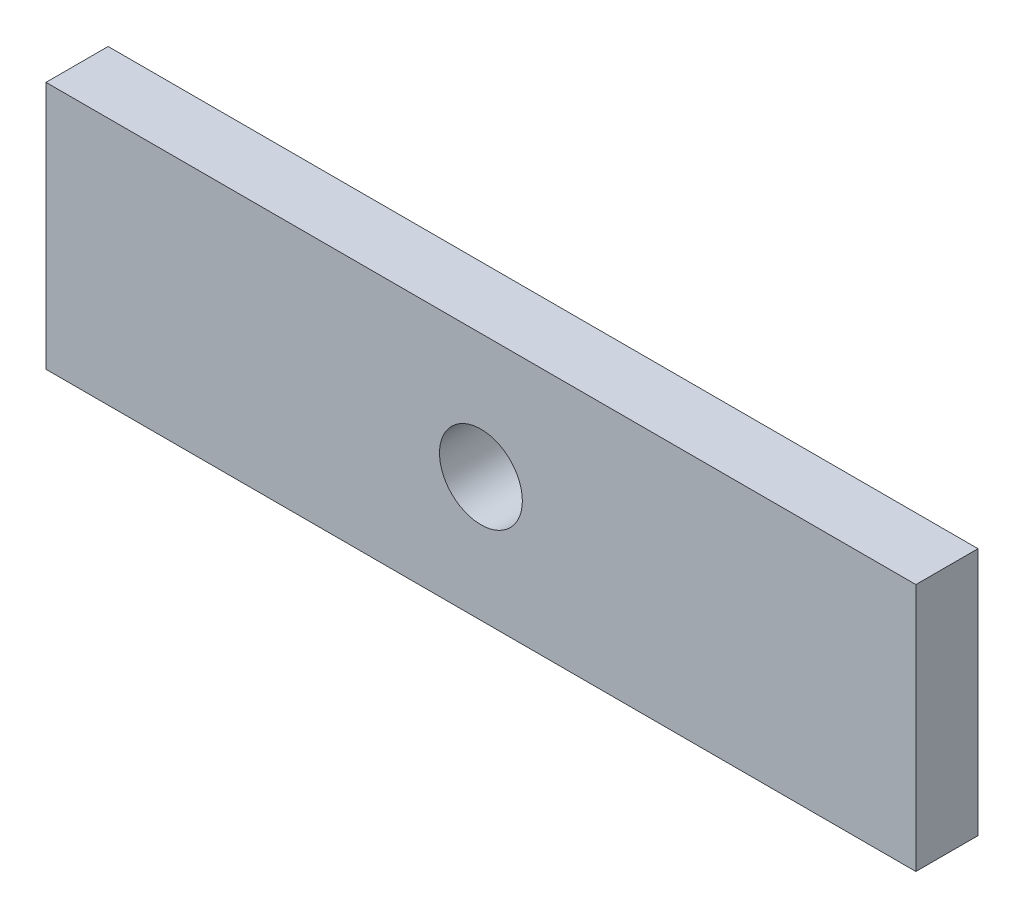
SolidWorks part; units mm, degrees
ref_plane "Front Plane" through (0, 0, 0) normal (0, 0, 1) x (1, 0, 0)
ref_plane "Top Plane" through (0, 0, 0) normal (0, 1, 0) x (1, 0, 0)
ref_plane "Right Plane" through (0, 0, 0) normal (1, 0, 0) x (0, 0, -1)
sketch "Sketch1" plane through (0, 0, 0) normal (0, 0, 1) x (1, 0, 0)
  line L0 (0, 60) -> (420, 60) construction
  line L1 (0, 0) -> (420, 0)
  line L2 (0, 0) -> (0, 120)
  line L3 (0, 120) -> (420, 120)
  line L4 (420, 0) -> (420, 120)
  circle A0 centre (210, 60) radius 20
  dimension "D4" = 40
  dimension "D1" = 210
  dimension "D2" = 210
  dimension "D3" = 120
extrude "Extrude1" add sketch "Sketch1" along normal blind 30
